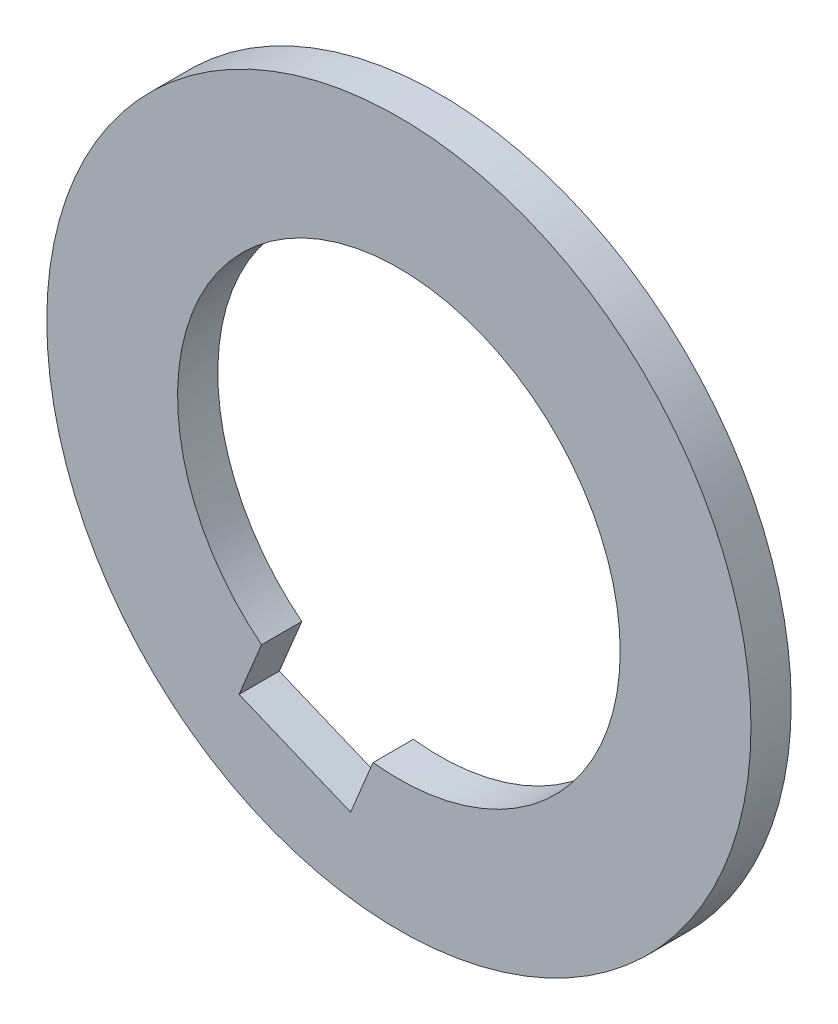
SolidWorks part; units mm, degrees
ref_plane "前视基准面" through (0, 0, 0) normal (0, 0, 1) x (1, 0, 0)
ref_plane "上视基准面" through (0, 0, 0) normal (0, 1, 0) x (1, 0, 0)
ref_plane "右视基准面" through (0, 0, 0) normal (1, 0, 0) x (0, 0, -1)
sketch "草图1" plane through (0, 0, 0) normal (0, 0, 1) x (1, 0, 0)
  line L0 (-1.2826, -10.925) -> (-2.4, -13.6195)
  line L1 (-2.4, -13.6195) -> (-7.9423, -11.3212)
  line L2 (-7.9423, -11.3212) -> (-6.825, -8.6267)
  circle A0 centre (0, 0) radius 17.5
  arc A1 (-1.2826, -10.925) -> (-6.825, -8.6267) centre (0, 0) ccw
  circle A2 centre (0, 0) radius 11 construction
  dimension "D1" = 35
extrude "拉伸1" add sketch "草图1" along normal blind 2
